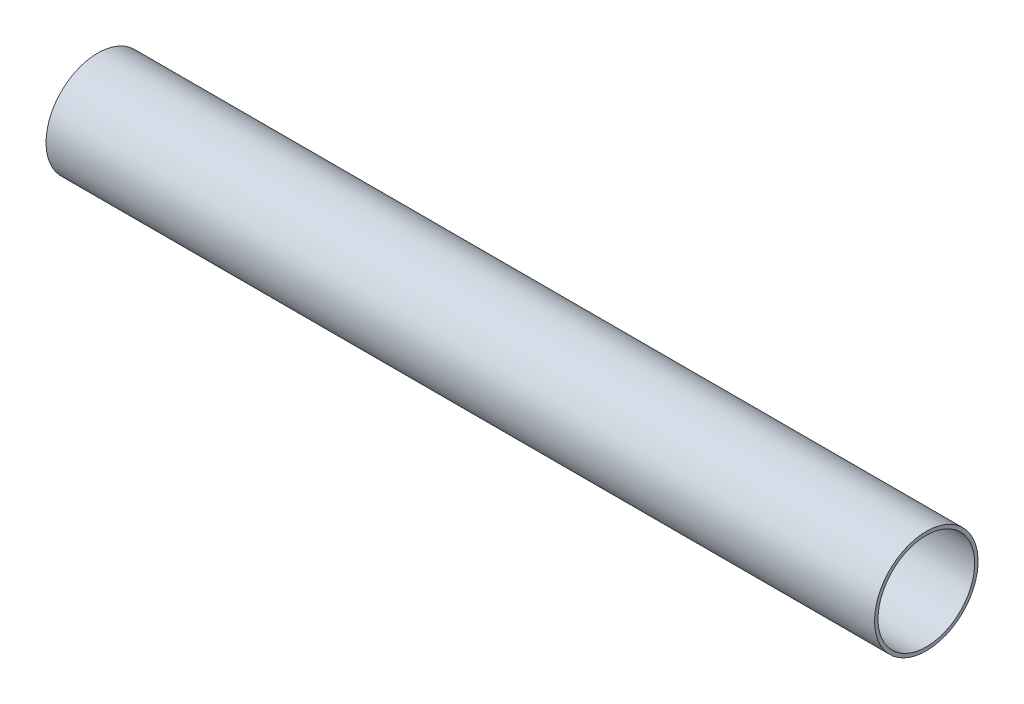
SolidWorks part; units mm, degrees
ref_plane "Front Plane" through (0, 0, 0) normal (0, 0, 1) x (1, 0, 0)
ref_plane "Top Plane" through (0, 0, 0) normal (0, 1, 0) x (1, 0, 0)
ref_plane "Right Plane" through (0, 0, 0) normal (1, 0, 0) x (0, 0, -1)
sketch "Sketch1" plane through (0, 0, 0) normal (1, 0, 0) x (0, 0, -1)
  circle A0 centre (0, 0) radius 19.05
  circle A1 centre (0, 0) radius 17.78
extrude "Boss-Extrude1" add sketch "Sketch1" along normal blind 304.8
